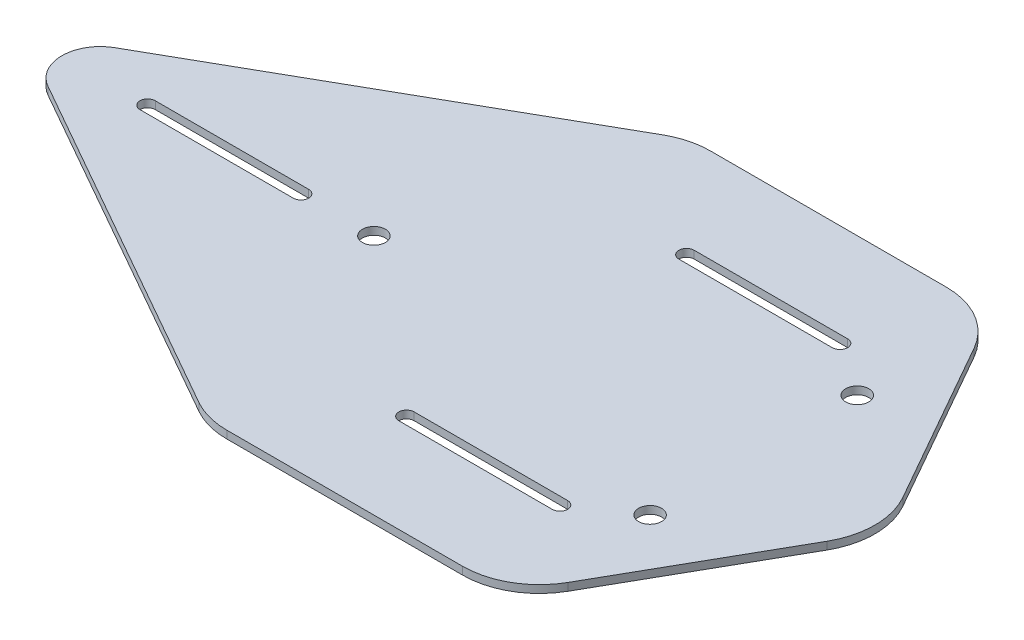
SolidWorks part; units mm, degrees
ref_plane "Ebene vorne" through (0, 0, 0) normal (0, 0, 1) x (1, 0, 0)
ref_plane "Ebene oben" through (0, 0, 0) normal (0, 1, 0) x (1, 0, 0)
ref_plane "Ebene rechts" through (0, 0, 0) normal (1, 0, 0) x (0, 0, -1)
sketch "Skizze1" plane through (0, 0, 0) normal (0, 1, 0) x (1, 0, 0)
  line L0 (0, 36.5) -> (0, -36.5) construction
  line L2 (20, 36.5) -> (-20, 36.5) construction
  line L3 (20, 34.5) -> (-20, 34.5)
  line L4 (20, 38.5) -> (-20, 38.5)
  line L5 (20, -36.5) -> (-20, -36.5) construction
  line L6 (20, -38.5) -> (-20, -38.5)
  line L7 (20, -34.5) -> (-20, -34.5)
  line L8 (-124, 0) -> (-84, 0) construction
  line L9 (-124, 2) -> (-84, 2)
  line L10 (-124, -2) -> (-84, -2)
  line L11 (-229.6562, 0) -> (-38.9562, 0) construction
  line L25 (-156.5964, 0) -> (-119.4714, 0) construction
  line L26 (21.1769, 63.0415) -> (21.1769, -63.0415) construction
  line L27 (0, 0) -> (53.0444, 0) construction
  line L28 (34, 27) -> (34, -27) construction
  line L29 (-104, 2) -> (-104, -2) construction
  line L30 (0, -34.5) -> (0, -38.5) construction
  line L31 (0, 38.5) -> (0, 34.5) construction
  line L32 (0, 0) -> (-104, 0) construction
  line L33 (21.1769, 63.0415) -> (-40.3034, 63.0415)
  line L34 (63.011, 9.8763) -> (38.5682, 52.9178)
  line L35 (38.5682, -52.9178) -> (63.011, -9.8763)
  line L36 (-40.3034, -63.0415) -> (21.1769, -63.0415)
  line L37 (-141.2841, -8.6957) -> (-50.1798, -60.4328)
  line L38 (-50.1798, 60.4328) -> (-141.2841, 8.6957)
  arc A0 (20, 34.5) -> (20, 38.5) centre (20, 36.5) ccw
  arc A1 (-20, 38.5) -> (-20, 34.5) centre (-20, 36.5) ccw
  arc A2 (20, -38.5) -> (20, -34.5) centre (20, -36.5) ccw
  arc A3 (-20, -34.5) -> (-20, -38.5) centre (-20, -36.5) ccw
  arc A4 (-124, 2) -> (-124, -2) centre (-124, 0) ccw
  arc A5 (-84, -2) -> (-84, 2) centre (-84, 0) ccw
  circle A6 centre (-65, 0) radius 3
  circle A16 centre (34, -27) radius 3
  circle A17 centre (34, 27) radius 3
  arc A18 (-141.2841, 8.6957) -> (-141.2841, -8.6957) centre (-136.3459, 0) ccw
  arc A19 (38.5682, 52.9178) -> (21.1769, 63.0415) centre (21.1769, 43.0415) ccw
  arc A20 (63.011, -9.8763) -> (63.011, 9.8763) centre (45.6196, 0) ccw
  arc A21 (21.1769, -63.0415) -> (38.5682, -52.9178) centre (21.1769, -43.0415) ccw
  arc A22 (-50.1798, -60.4328) -> (-40.3034, -63.0415) centre (-40.3034, -43.0415) ccw
  arc A23 (-50.1798, 60.4328) -> (-40.3034, 63.0415) centre (-40.3034, 43.0415) cw
  point P7 (0, 36.5)
  point P13 (0, -36.5)
  point P19 (-104, 0)
  point P32 (65, 0)
  point P119 (68.6196, 0)
  point P120 (21.1769, 0)
  point P121 (34, 0)
  dimension "D3" = 4
  dimension "D8" = 65
  dimension "D9" = 6
  dimension "D1" = 104
  dimension "D2" = 73
  dimension "D4" = 40
  dimension "D5" = 54
  dimension "D6" = 34
  dimension "D7" = 65
extrude "Aufsatz-Linear austragen1" add sketch "Skizze1" along normal blind 2
